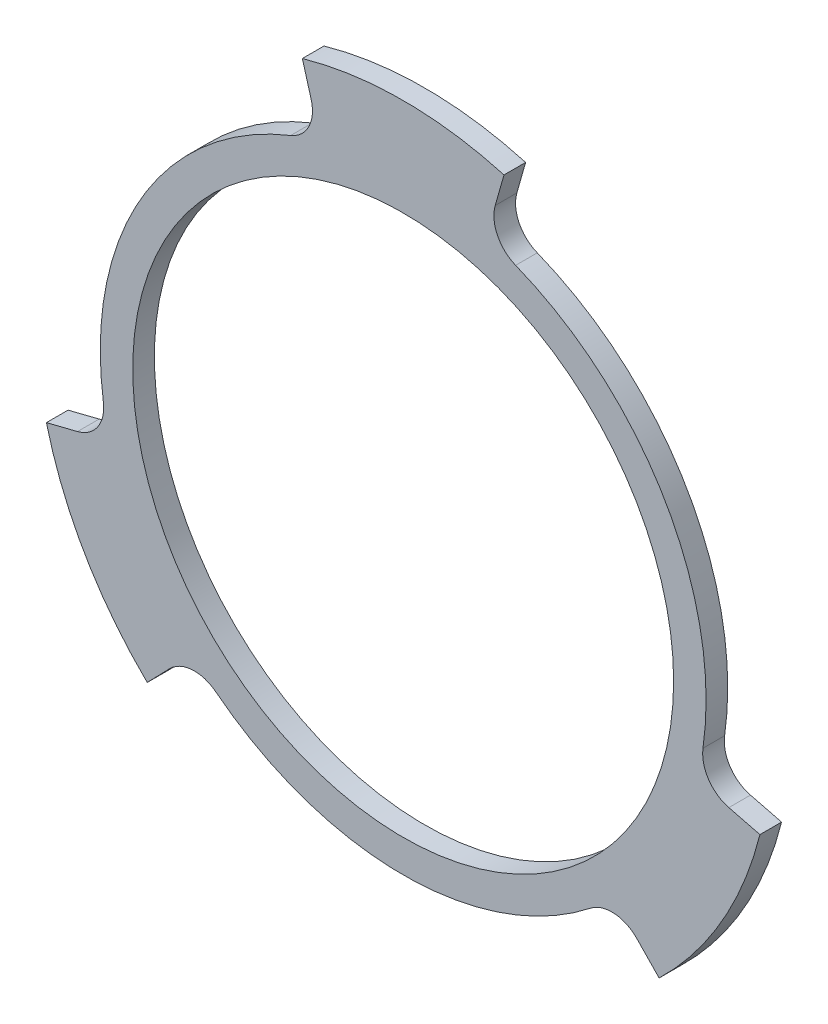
SolidWorks part; units mm, degrees
ref_plane "Front Plane" through (0, 0, 0) normal (0, 0, 1) x (1, 0, 0)
ref_plane "Top Plane" through (0, 0, 0) normal (0, 1, 0) x (1, 0, 0)
ref_plane "Right Plane" through (0, 0, 0) normal (1, 0, 0) x (0, 0, -1)
sketch "Sketch1" plane through (0, 0, 0) normal (0, 0, 1) x (1, 0, 0)
  line L0 (0, 0) -> (0, 38.5046) construction
  line L1 (0, 0) -> (47.0716, -27.1768) construction
  line L2 (0, 0) -> (-45.4038, -26.2139) construction
  line L3 (-7.3971, 25.954) -> (-6.0917, 21.3739)
  line L4 (7.3971, 25.954) -> (6.0917, 21.3739)
  line L5 (26.1753, -6.5709) -> (21.5562, -5.4113)
  line L6 (18.7783, -19.383) -> (15.4644, -15.9625)
  line L7 (-18.7783, -19.383) -> (-15.4644, -15.9625)
  line L8 (-26.1753, -6.5709) -> (-21.5562, -5.4113)
  circle A0 centre (0, 0) radius 19.8438
  arc A1 (26.1753, -6.5709) -> (18.7783, -19.383) centre (0, 0) cw
  arc A2 (-18.7783, -19.383) -> (-26.1753, -6.5709) centre (0, 0) cw
  arc A3 (-7.3971, 25.954) -> (7.3971, 25.954) centre (0, 0) cw
  arc A4 (-21.5562, -5.4113) -> (-6.0917, 21.3739) centre (0, 0) cw
  arc A5 (21.5562, -5.4113) -> (6.0917, 21.3739) centre (0, 0) ccw
  arc A6 (15.4644, -15.9625) -> (-15.4644, -15.9625) centre (0, 0) cw
  dimension "D1" = 39.6875
  dimension "D2" = 26.9875
  dimension "D4" = 120
  dimension "D5" = 120
extrude "Extrude1" add sketch "Sketch1" along normal blind 1.5875 contours A6 L6 A1 L5 A5 L4 A3 L3 A4 L8 A2 L7 A0
fillet "Fillet1" radius 2.54 6 edges at (-6.0917, 21.3739, 0.7937) (21.5562, -5.4113, 0.7937) (6.0917, 21.3739, 0.7937) (15.4644, -15.9625, 0.7937) (-15.4644, -15.9625, 0.7937) (-21.5562, -5.4113, 0.7937)
